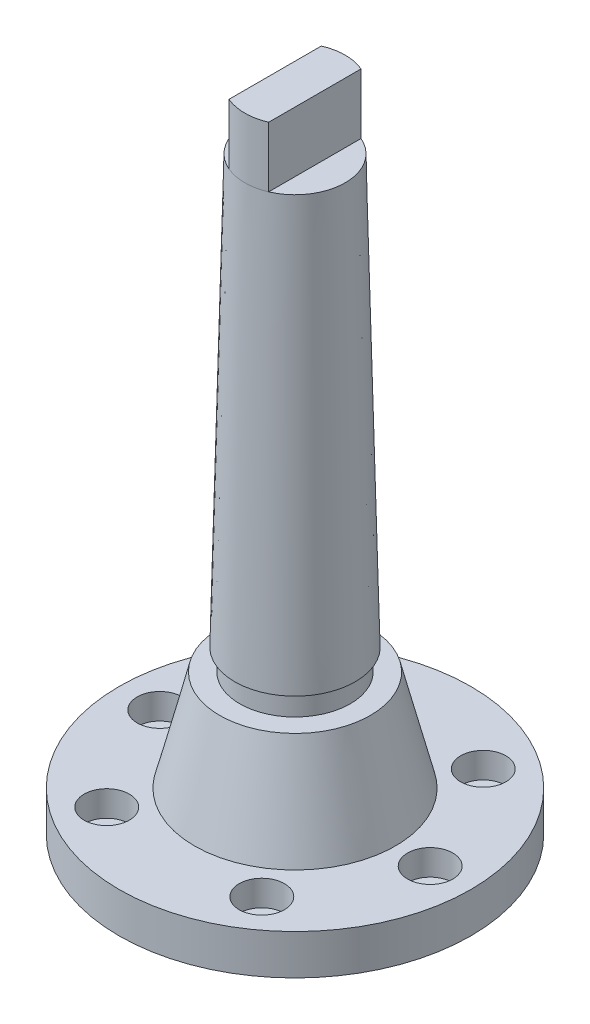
SolidWorks part; units mm, degrees
ref_plane "Front Plane" through (0, 0, 0) normal (0, 0, 1) x (1, 0, 0)
ref_plane "Top Plane" through (0, 0, 0) normal (0, 1, 0) x (1, 0, 0)
ref_plane "Right Plane" through (0, 0, 0) normal (1, 0, 0) x (0, 0, -1)
sketch "Sketch1" plane through (0, 0, 0) normal (0, 1, 0) x (1, 0, 0)
  circle A0 centre (0, 0) radius 17.95
  dimension "D1" = 35.9
extrude "Boss-Extrude1" add sketch "Sketch1" along normal blind 8
sketch "Sketch2" plane through (0, 8, 0) normal (0, 1, 0) x (1, 0, 0)
  circle A0 centre (0, 0) radius 35
  dimension "D1" = 70
extrude "Boss-Extrude2" add sketch "Sketch2" along normal blind 8
sketch "Sketch3" plane through (0, 16, 0) normal (0, 1, 0) x (1, 0, 0)
  line L0 (0, 0) -> (-26.9, 0) construction
  line L1 (0, 0) -> (26.9, 0) construction
  circle A0 centre (0, 0) radius 26.9 construction
  circle A1 centre (-26.9, 0) radius 2.7
  circle A2 centre (-15.4292, 22.0352) radius 2.7
  circle A3 centre (15.4292, 22.0352) radius 2.7
  circle A4 centre (26.9, 0) radius 2.7
  circle A5 centre (15.4292, -22.0352) radius 2.7
  circle A6 centre (-15.4292, -22.0352) radius 2.7
  point P3 (26.9, 0.6182)
  point P9 (12.9234, 23.5923)
  point P15 (-1.9322, 26.8305)
  dimension "D1" = 53.8
  dimension "D2" = 5.4
  dimension "D3" = 55
  dimension "D4" = 55
  dimension "D5" = 55
  dimension "D6" = 55
extrude "Cut-Extrude2" cut sketch "Sketch3" against normal up to next
sketch "Sketch4" plane through (0, 16, 0) normal (0, 1, 0) x (1, 0, 0)
  circle A0 centre (-15.4292, 22.0352) radius 4.5
  circle A1 centre (15.4292, 22.0352) radius 4.5
  circle A2 centre (26.9, 0) radius 4.5
  circle A3 centre (15.4292, -22.0352) radius 4.5
  circle A4 centre (-15.4292, -22.0352) radius 4.5
  circle A5 centre (-26.9, 0) radius 4.5
  dimension "D1" = 9
extrude "Cut-Extrude3" cut sketch "Sketch4" against normal blind 5.1
ref_plane "Plane1" through (0, 36, 0) normal (0, 1, 0) x (1, 0, 0)
sketch "Sketch6" plane through (0, 36, 0) normal (0, 1, 0) x (1, 0, 0)
  circle A0 centre (0, 0) radius 35 construction
  circle A1 centre (0, 0) radius 35 construction
  circle A2 centre (0, 0) radius 11
  dimension "D1" = 22
extrude "Boss-Extrude4" add sketch "Sketch6" along normal blind 4.3 separate body
sketch "Sketch7" plane through (0, 40.3, 0) normal (0, 1, 0) x (1, 0, 0)
  circle A0 centre (0, 0) radius 12
  dimension "D1" = 24
ref_plane "Plane2" through (0, 125.3, 0) normal (0, 1, 0) x (1, 0, 0)
sketch "Sketch8" plane through (0, 125.3, 0) normal (0, 1, 0) x (1, 0, 0)
  circle A0 centre (0, 0) radius 12 construction
  circle A1 centre (0, 0) radius 12 construction
  circle A2 centre (0, 0) radius 10
  dimension "D1" = 20
loft "Loft1" add profiles "Sketch7", "Sketch8"
sketch "Sketch9" plane through (0, 16, 0) normal (0, 1, 0) x (1, 0, 0)
  circle A0 centre (0, 0) radius 20
  dimension "D1" = 40
sketch "Sketch10" plane through (0, 36, 0) normal (0, -1, 0) x (-1, 0, 0)
  circle A0 centre (0, 0) radius 15
  dimension "D1" = 30
loft "Loft2" add profiles "Sketch9", "Sketch10"
sketch "Sketch11" plane through (0, 125.3, 0) normal (0, 1, 0) x (1, 0, 0)
  line L0 (-3.95, -9.1868) -> (-3.95, 9.1868)
  line L1 (3.95, 9.1868) -> (3.95, -9.1868)
  circle A0 centre (0, 0) radius 10 construction
  arc A1 (-3.95, -9.1868) -> (3.95, -9.1868) centre (0, 0) ccw
  arc A2 (-3.95, 9.1868) -> (3.95, 9.1868) centre (0, 0) cw
  point P9 (0, 0)
  dimension "D1" = 3.95
  dimension "D2" = 3.95
extrude "Boss-Extrude5" add sketch "Sketch11" along normal blind 12
